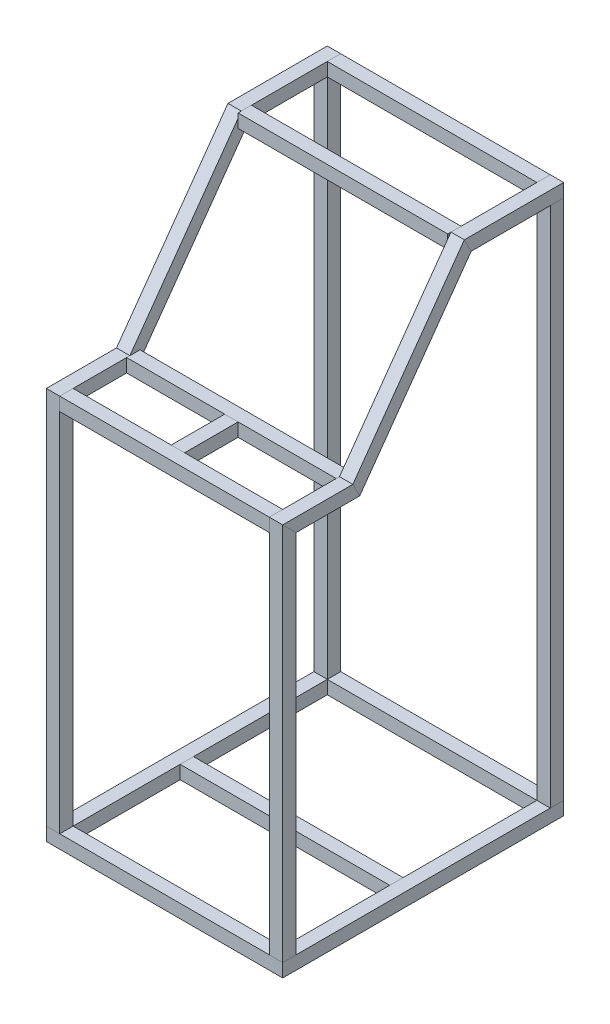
SolidWorks part; units mm, degrees
ref_plane "Płaszczyzna przednia" through (0, 0, 0) normal (0, 0, 1) x (1, 0, 0)
ref_plane "Płaszczyzna górna" through (0, 0, 0) normal (0, 1, 0) x (1, 0, 0)
ref_plane "Płaszczyzna prawa" through (0, 0, 0) normal (1, 0, 0) x (0, 0, -1)
sketch3d "Szkic 3D1"
  line L0 (-250, -1200, 0) -> (-250, 0, 0)
  line L1 (-250, 0, 0) -> (250, 0, 0)
  line L2 (250, 0, 0) -> (250, -1200, 0)
  line L3 (-250, 0, 0) -> (-250, 0, 200)
  line L4 (-250, 0, 200) -> (-250, -350, 450)
  line L5 (-250, -350, 450) -> (-250, -350, 600)
  line L6 (-250, -350, 600) -> (-250, -1200, 600)
  line L7 (250, 0, 0) -> (250, 0, 200)
  line L8 (250, 0, 200) -> (250, -350, 450)
  line L9 (250, -350, 450) -> (250, -350, 600)
  line L10 (250, -350, 600) -> (250, -1200, 600)
  line L11 (-250, -350, 600) -> (250, -350, 600)
  line L12 (-250, -350, 450) -> (250, -350, 450)
  line L13 (-250, 0, 200) -> (250, 0, 200)
  line L14 (-250, -1200, 0) -> (-250, -1200, 600)
  line L15 (-250, -1200, 600) -> (250, -1200, 600)
  line L16 (250, -1200, 600) -> (250, -1200, 0)
  line L17 (250, -1200, 0) -> (-250, -1200, 0)
  line L18 (-250, -1200, 330) -> (250, -1200, 330)
  line L19 (0, -350, 600) -> (0, -350, 450)
  dimension "D1" = 1200
  dimension "D2" = 850
  dimension "D3" = 150
  dimension "D4" = 200
  dimension "D5" = 600
  dimension "D6" = 500
  dimension "D7" = 270
other "Człon konstrukcyjny1"
ref_plane "Płaszczyzna1" through (-250, -1200, 0) normal (0, 0, 1) x (1, 0, 0)
sketch "Szkic1" plane through (-250, -1200, 0) normal (0, 0, 1) x (1, 0, 0)
  line L0 (12, -12) -> (12, 12)
  line L1 (15, -15) -> (-15, -15)
  line L2 (15, -15) -> (15, 15)
  line L3 (15, 15) -> (-15, 15)
  line L4 (-15, -15) -> (-15, 15)
  line L5 (15, -15) -> (-15, 15) construction
  line L6 (15, 15) -> (-15, -15) construction
  line L7 (12, 12) -> (-12, 12)
  line L8 (-12, -12) -> (-12, 12)
  line L9 (12, -12) -> (-12, -12)
  point P0 (0, 0)
  point P10 (0, 15)
  point P11 (-15, 0)
  point P12 (0, -15)
  point P13 (15, 0)
  point P14 (0, 0)
  point P15 (0, 0)
  point P16 (0, 0)
  point P17 (0, 0)
  point P18 (0, 0)
  dimension "D2" = 30
  dimension "D3" = 30
  dimension "D1" = 3
other "Przytnij/Wydłuż1"
